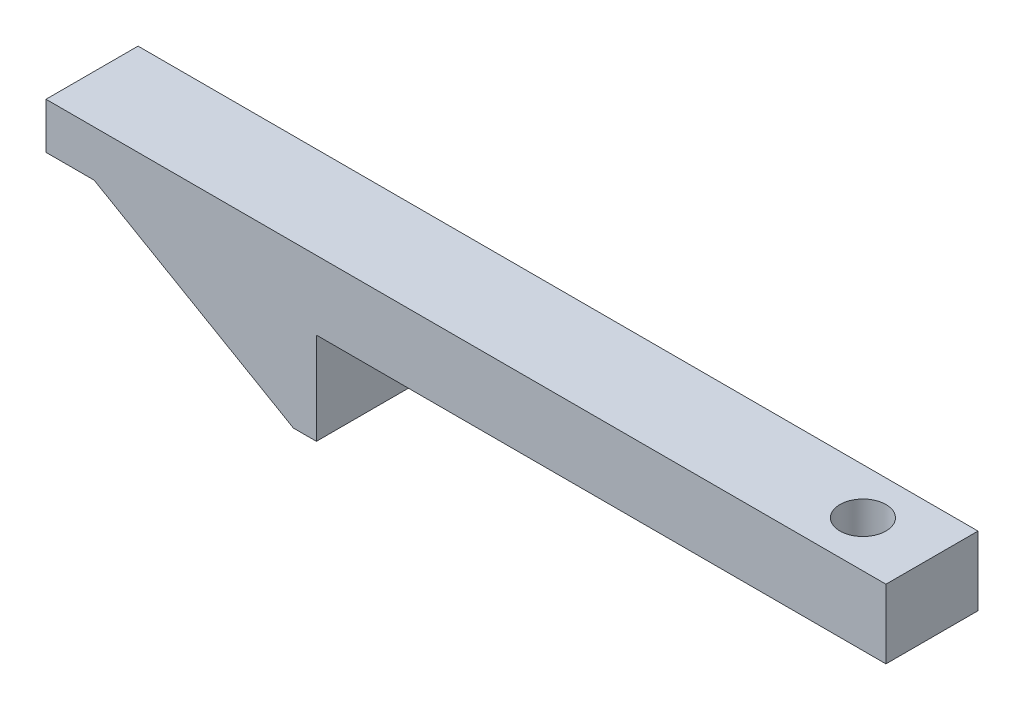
SolidWorks part; units mm, degrees
ref_plane "Front Plane" through (0, 0, 0) normal (0, 0, 1) x (1, 0, 0)
ref_plane "Top Plane" through (0, 0, 0) normal (0, 1, 0) x (1, 0, 0)
ref_plane "Right Plane" through (0, 0, 0) normal (1, 0, 0) x (0, 0, -1)
sketch "Sketch1" plane through (0, 0, 0) normal (0, 0, 1) x (1, 0, 0)
  line L0 (0, 0) -> (9.525, 0)
  line L1 (9.525, 0) -> (9.525, -9.525)
  line L2 (9.525, -9.525) -> (-69.0626, -9.525)
  line L3 (-69.0626, -9.525) -> (-69.0626, -22.225)
  line L4 (-69.0626, -22.225) -> (-72.2376, -22.225)
  line L5 (-72.2376, -22.225) -> (-99.7339, -6.35)
  line L6 (-99.7339, -6.35) -> (-106.3752, -6.35)
  line L7 (-106.3752, -6.35) -> (-106.3752, 0)
  line L8 (-106.3752, 0) -> (0, 0)
  line L9 (0, 0) -> (0, -9.525) construction
  dimension "D1" = 9.525
  dimension "D2" = 106.3752
  dimension "D3" = 6.35
  dimension "D4" = 9.525
  dimension "D5" = 12.7
  dimension "D6" = 30
  dimension "D7" = 3.175
  dimension "D8" = 69.0626
  dimension "D9" = 6.6413
sketch "Sketch2" plane through (0, 0, 0) normal (0, 0, 1) x (1, 0, 0)
  line L0 (-72.2376, -22.225) -> (-99.7339, -6.35) construction
  line L1 (-99.7339, -6.35) -> (-106.3752, -6.35) construction
  line L2 (-106.3752, -6.35) -> (-106.3752, 0) construction
  line L3 (-106.3752, 0) -> (0, 0) construction
  line L4 (0, 0) -> (9.525, 0) construction
  line L5 (9.525, 0) -> (9.525, -9.525) construction
  line L6 (9.525, -9.525) -> (-69.0626, -9.525) construction
  line L7 (-69.0626, -9.525) -> (-69.0626, -22.225) construction
  line L8 (-69.0626, -22.225) -> (-72.2376, -22.225) construction
  line L9 (-72.2376, -22.225) -> (-99.7339, -6.35)
  line L10 (-99.7339, -6.35) -> (-106.3752, -6.35)
  line L11 (-106.3752, -6.35) -> (-106.3752, 0)
  line L12 (-106.3752, 0) -> (0, 0)
  line L13 (0, 0) -> (9.525, 0)
  line L14 (9.525, 0) -> (9.525, -9.525)
  line L15 (9.525, -9.525) -> (-69.0626, -9.525)
  line L16 (-69.0626, -9.525) -> (-69.0626, -22.225)
  line L17 (-69.0626, -22.225) -> (-72.2376, -22.225)
extrude "Boss-Extrude1" add sketch "Sketch2" along normal mid plane 12.7
hole_wizard "1/4 (0.25) Diameter Hole1" positions "Sketch4" profile "Sketch3" hole size "1/4" standard "ANSI Inch"
sketch "Sketch4" plane through (0, -9.525, 0) normal (0, -1, 0) x (-1, 0, 0)
  point P0 (0, 0)
sketch "Sketch3" plane through (0, -9.525, 0) normal (1, 0, 0) x (0, 0, -1)
  line L0 (0, 0) -> (0, 24.1327)
  line L1 (0, 24.1327) -> (3.175, 22.225)
  line L2 (3.175, 22.225) -> (3.175, 0)
  line L5 (3.175, 0) -> (0, 0)
  line L10 (0, 24.1327) -> (-3.175, 22.225) construction
  line L11 (0, -6.35) -> (0, 107.95) construction
  dimension "Hole Dia." = 6.35
  dimension "Hole Depth" = 22.225
  dimension "Drill Angle" = 118
